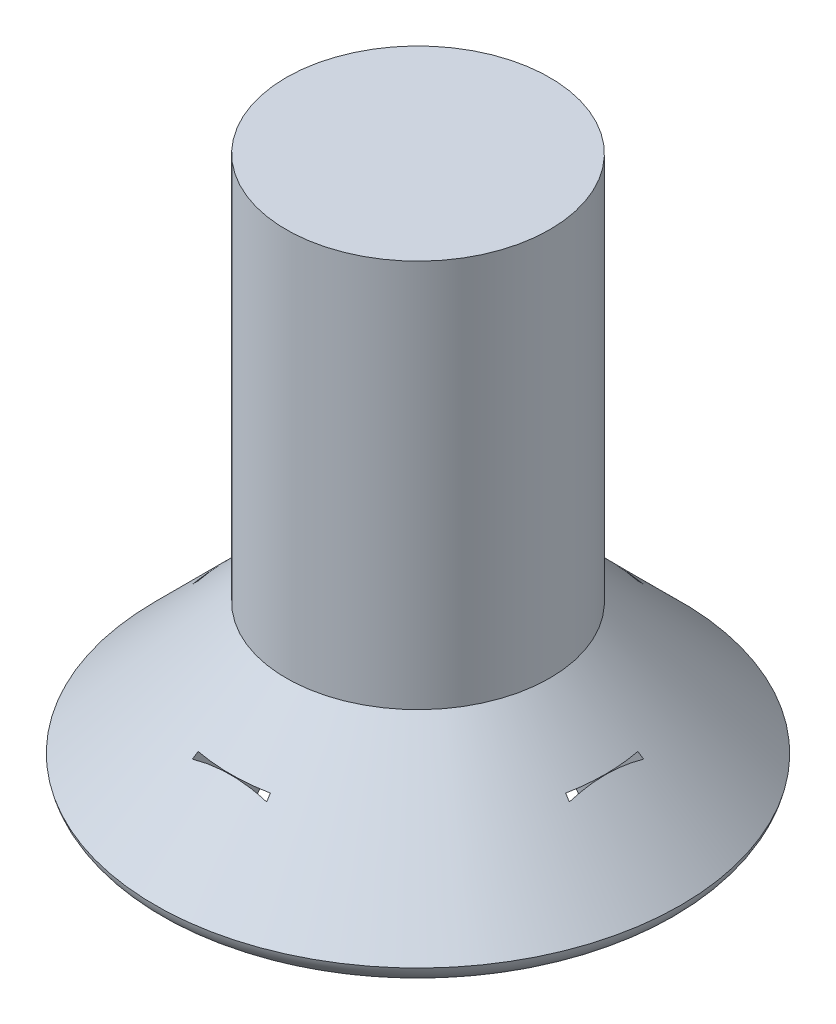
SolidWorks part; units mm, degrees
ref_plane "Face" through (0, 0, 0) normal (0, 0, 1) x (1, 0, 0)
ref_plane "Dessus" through (0, 0, 0) normal (0, 1, 0) x (1, 0, 0)
ref_plane "Droite" through (0, 0, 0) normal (1, 0, 0) x (0, 0, -1)
sketch "Esquisse1" plane through (0, 0, 0) normal (0, 0, 1) x (1, 0, 0)
  line L0 (0, 0) -> (0, 3.9) construction
  line L1 (0, 0) -> (1.6994, 0)
  line L2 (1.8949, 0.1551) -> (0.95, 1.1)
  line L3 (0, 3.9) -> (0, 0)
  line L4 (0.95, 3.9) -> (0.95, 1.1)
  line L5 (0, 3.9) -> (0.95, 3.9)
  line L6 (1.9, 1.0014) -> (1.9, -0.3576) construction
  arc A0 (1.8949, 0.1551) -> (1.6994, 0) centre (1.7, 0.2) cw
  dimension "D1" = 0.95
  dimension "D2" = 3.9
  dimension "D3" = 0.2
  dimension "D4" = 1.9
  dimension "D5" = 1.6994
  dimension "D6" = 2.8
  dimension "D7" = 45
revolve "Base-Révolution" add sketch "Esquisse1" angle 360 about L0
sketch "Esquisse2" plane through (0, 0, 0) normal (0, -1, 0) x (1, 0, 0)
  line L0 (0.409, -1.5) -> (0.409, -0.9418)
  line L1 (-0.409, -1.5) -> (-0.409, -0.9418)
  line L2 (1.5, 0.409) -> (0.9418, 0.409)
  line L3 (1.5, -0.409) -> (0.9418, -0.409)
  line L4 (1.5, 0.409) -> (1.5, -0.409)
  line L5 (0.409, -1.5) -> (-0.409, -1.5)
  line L6 (-1.5, -0.409) -> (-0.9418, -0.409)
  line L7 (-1.5, 0.409) -> (-0.9418, 0.409)
  line L8 (-1.5, -0.409) -> (-1.5, 0.409)
  line L9 (-0.409, 1.5) -> (-0.409, 0.9418)
  line L10 (0.409, 1.5) -> (0.409, 0.9418)
  line L11 (-0.409, 1.5) -> (0.409, 1.5)
  arc A0 (-0.9418, 0.409) -> (-0.409, 0.9418) centre (-0.9418, 0.9418) ccw
  arc A1 (0.9418, 0.409) -> (0.409, 0.9418) centre (0.9418, 0.9418) cw
  arc A2 (0.9418, -0.409) -> (0.409, -0.9418) centre (0.9418, -0.9418) ccw
  arc A3 (-0.409, -0.9418) -> (-0.9418, -0.409) centre (-0.9418, -0.9418) ccw
  dimension "D1" = 1.5
  dimension "D2" = 1.5
  dimension "D3" = 1.5
extrude "Enlèv. mat.-Extru.1" cut sketch "Esquisse2" against normal blind 0.7 draft 12
